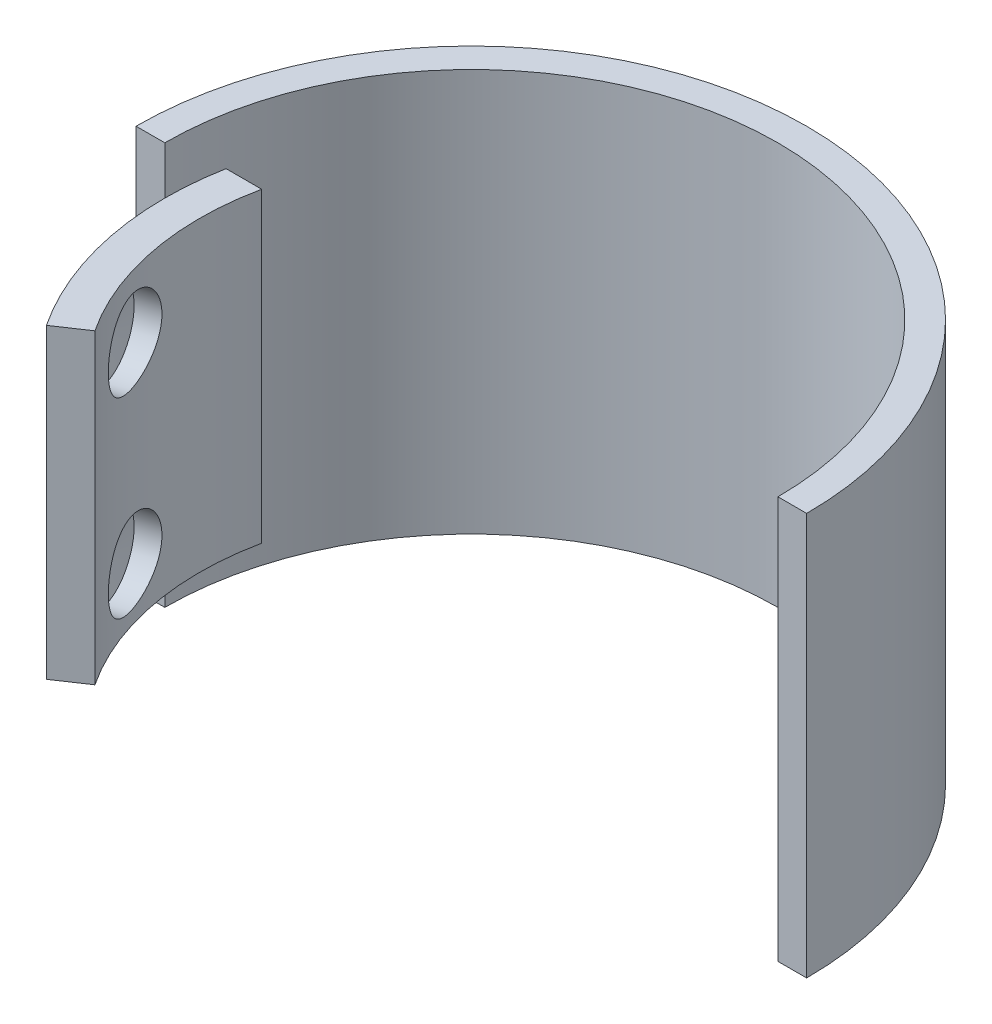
SolidWorks part; units mm, degrees
ref_plane "Plan de face" through (0, 0, 0) normal (0, 0, 1) x (1, 0, 0)
ref_plane "Plan de dessus" through (0, 0, 0) normal (0, 1, 0) x (1, 0, 0)
ref_plane "Plan de droite" through (0, 0, 0) normal (1, 0, 0) x (0, 0, -1)
sketch "Esquisse1" plane through (0, 0, 0) normal (0, 1, 0) x (1, 0, 0)
  line L0 (-35, 0) -> (-32, 0)
  line L1 (35, 0) -> (32, 0)
  line L2 (-27.7439, 5.8586) -> (-31.4591, 5.8586)
  line L3 (-23.6489, -15.6454) -> (-26.6745, -17.6769)
  arc A0 (32, 0) -> (-31.4591, 5.8586) centre (0, 0) ccw
  arc A1 (-32, 0) -> (-29.8668, -11.4881) centre (0, 0) ccw
  arc A2 (35, 0) -> (-35, 0) centre (0, 0) ccw
  arc A3 (-27.7439, 5.8586) -> (-23.6489, -15.6454) centre (0, 0) ccw
  arc A4 (-29.8668, -11.4881) -> (-26.6745, -17.6769) centre (0, 0) ccw
  dimension "D1" = 35
  dimension "D2" = 3
extrude "Boss.-Extru.1" add sketch "Esquisse1" along normal blind 42
hole_wizard "Dégagement M102" positions "Esquisse3D5" profile "Esquisse4" hole size "M10" standard "Ansi Metric"
sketch3d "Esquisse3D5"
  line L0 (-23.6489, 42, 15.6454) -> (-23.6489, 0, 15.6454) construction
  point P0 (-27.0776, 30.6441, 8.4174)
  point P2 (-27.0776, 10.6441, 8.4174)
  dimension "D1" = 20
  dimension "D2" = 8
  dimension "D3" = 8
sketch "Esquisse4" plane through (-27.0776, 30.6441, 8.4174) normal (0, 1, 0) x (-0.2968, 0, -0.9549)
  line L0 (0, 0) -> (0, 2.5595)
  line L1 (0, 2.5595) -> (4.25, 2)
  line L2 (4.25, 2) -> (4.25, 0)
  line L5 (4.25, 0) -> (0, 0)
  line L10 (0, 2.5595) -> (-4.25, 2) construction
  line L11 (0, -6.35) -> (0, 107.95) construction
  dimension "Diamètre du perçage" = 8.5
  dimension "Profondeur du perçage" = 2
  dimension "Angle de pointe" = 165
sketch "Esquisse5" plane through (0, 42, 0) normal (0, 1, 0) x (1, 0, 0)
  line L0 (-25.7919, 7.2081) -> (-30.8614, 8.46)
  line L1 (-21.154, -16.4221) -> (-25.7919, -18.9414)
  arc A0 (-30.8614, 8.46) -> (-25.7919, -18.9414) centre (0, 0) ccw
  arc A1 (32, 0) -> (-31.4591, 5.8586) centre (0, 0) ccw construction
  arc A2 (-25.7919, 7.2081) -> (-21.154, -16.4221) centre (0, 0) ccw
extrude "Enlèv. mat.-Extru.1" cut sketch "Esquisse5" against normal blind 5
sketch "Esquisse6" plane through (0, 0, 0) normal (0, -1, 0) x (1, 0, 0)
  line L0 (-24.2777, 20.8469) -> (-20.042, 17.9384)
  line L1 (-25.4091, -8.8231) -> (-30.2616, -10.4036)
  arc A0 (-30.2616, -10.4036) -> (-24.2777, 20.8469) centre (0, 0) cw
  arc A1 (-31.4591, -5.8586) -> (32, 0) centre (0, 0) ccw construction
  arc A2 (-25.4091, -8.8231) -> (-20.042, 17.9384) centre (0, 0) cw
extrude "Enlèv. mat.-Extru.2" cut sketch "Esquisse6" against normal blind 5
hole_wizard "Dégagement M103" positions "Esquisse3D7" profile "Esquisse7" hole size "M10" standard "Ansi Metric"
sketch3d "Esquisse3D7"
  line L0 (32, 42, 0) -> (32, 0, 0) construction
  point P0 (30.4375, 30.4419, -9.8772)
  point P2 (30.4375, 10.4419, -9.8772)
  dimension "D1" = 10
  dimension "D2" = 10
  dimension "D3" = 20
sketch "Esquisse7" plane through (30.4375, 30.4419, -9.8772) normal (0, 1, 0) x (0.3087, 0, 0.9512)
  line L0 (0, 0) -> (0, 2.5595)
  line L1 (0, 2.5595) -> (4.25, 2)
  line L2 (4.25, 2) -> (4.25, 0)
  line L5 (4.25, 0) -> (0, 0)
  line L10 (0, 2.5595) -> (-4.25, 2) construction
  line L11 (0, -6.35) -> (0, 107.95) construction
  dimension "Diamètre du perçage" = 8.5
  dimension "Profondeur du perçage" = 2
  dimension "Angle de pointe" = 165
